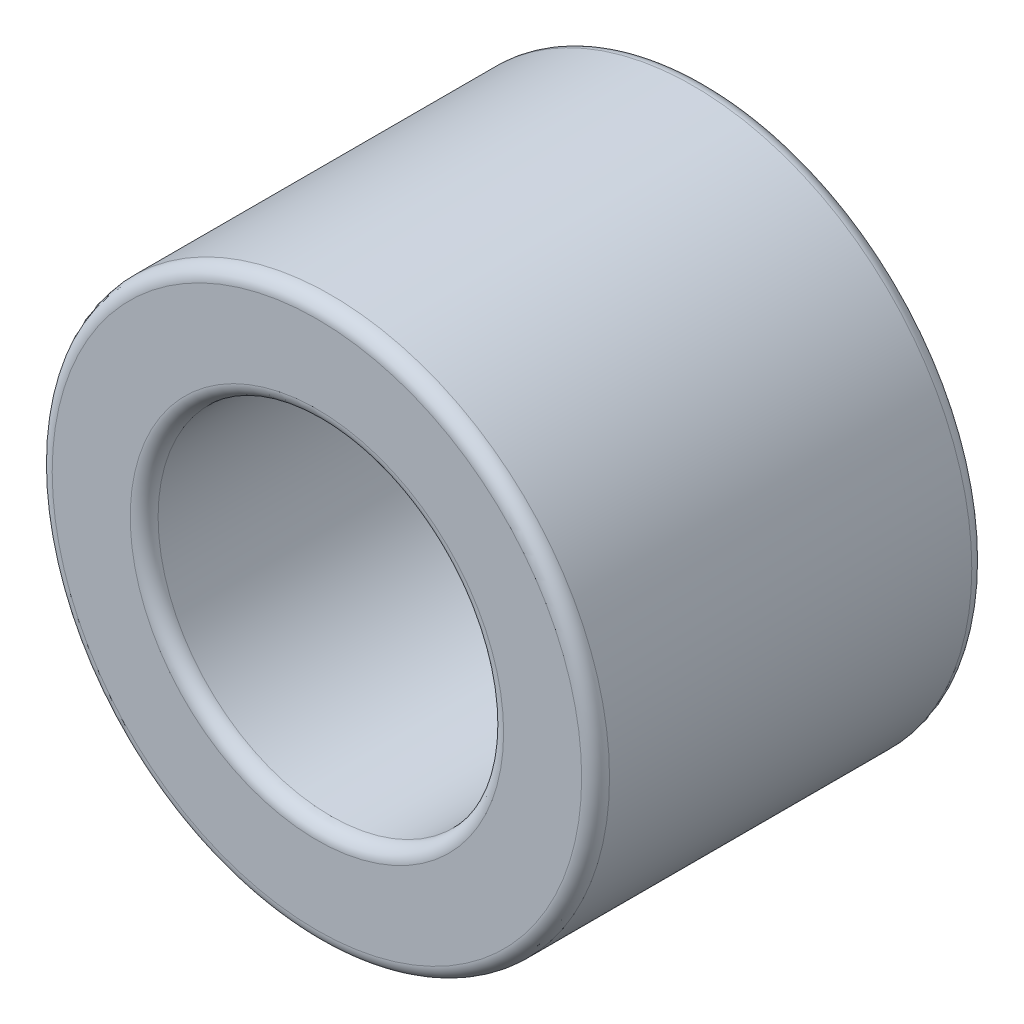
SolidWorks part; units mm, degrees
ref_plane "Спереди" through (0, 0, 0) normal (0, 0, 1) x (1, 0, 0)
ref_plane "Сверху" through (0, 0, 0) normal (0, 1, 0) x (1, 0, 0)
ref_plane "Справа" through (0, 0, 0) normal (1, 0, 0) x (0, 0, -1)
sketch "Эскиз1" plane through (0, 0, 0) normal (0, 0, 1) x (1, 0, 0)
  circle A0 centre (0, 0) radius 6.2
  circle A1 centre (0, 0) radius 10
  dimension "D1" = 20
  dimension "D2" = 12.4
extrude "Бобышка-Вытянуть1" add sketch "Эскиз1" along normal mid plane 14
fillet "Скругление1" radius 0.5 4 edges at (6.2, 0, -7) (6.2, 0, 7) (10, 0, -7) (10, 0, 7)
